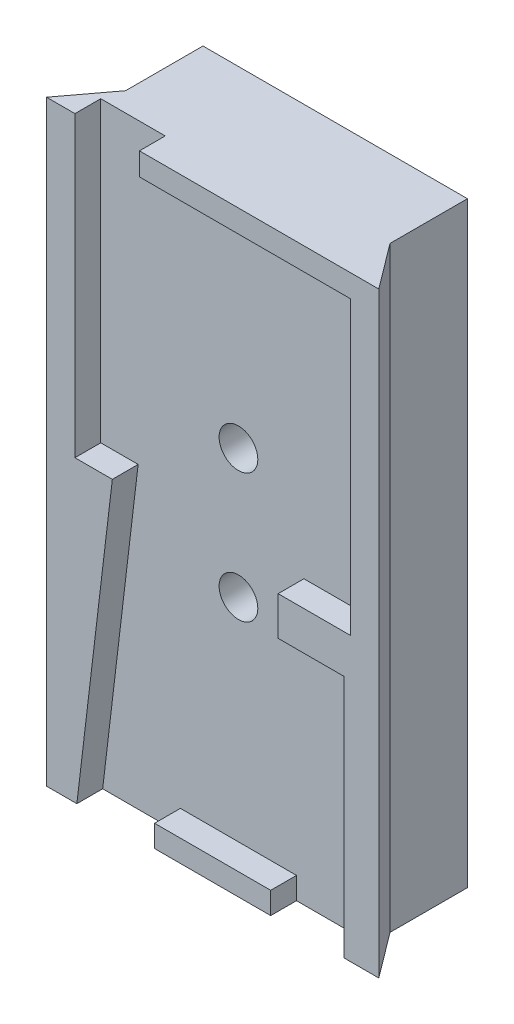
SolidWorks part; units mm, degrees
ref_plane "Спереди" through (0, 0, 0) normal (0, 0, 1) x (1, 0, 0)
ref_plane "Сверху" through (0, 0, 0) normal (0, 1, 0) x (1, 0, 0)
ref_plane "Справа" through (0, 0, 0) normal (1, 0, 0) x (0, 0, -1)
sketch "Эскиз1" plane through (0, 0, 0) normal (0, 1, 0) x (1, 0, 0)
  line L0 (0, 0) -> (0, 27.9699) construction
  line L1 (0, 0) -> (37.9449, 0) construction
  line L2 (-20.5, 0) -> (20.5, 0)
  line L3 (20.5, 0) -> (20.5, -12)
  line L4 (20.5, -12) -> (25.75, -19)
  line L5 (25.75, -19) -> (-25.75, -19)
  line L6 (0, 0) -> (0, -19) construction
  line L7 (-20.5, -12) -> (-25.75, -19)
  line L8 (-20.5, 0) -> (-20.5, -12)
  dimension "D1" = 41
  dimension "D2" = 7
  dimension "D3" = 12
  dimension "D4" = 51.5
extrude "Бобышка-Вытянуть1" add sketch "Эскиз1" along normal blind 92.5
sketch "Эскиз2" plane through (0, 0, 19) normal (0, 0, 1) x (1, 0, 0)
  line L0 (-21.05, 0) -> (-15.55, 46.3)
  line L1 (-25.75, 0) -> (25.75, 0) construction
  line L2 (-15.55, 46.3) -> (-21.35, 46.3)
  line L3 (-21.35, 46.3) -> (-21.35, 92.5)
  line L4 (-25.75, 92.5) -> (25.75, 92.5) construction
  line L5 (-21.35, 92.5) -> (-11.35, 92.5)
  line L6 (-11.35, 92.5) -> (-11.35, 89)
  line L7 (-11.35, 89) -> (21.35, 89)
  line L8 (21.35, 89) -> (21.35, 43.8)
  line L9 (21.35, 43.8) -> (10.15, 43.8)
  line L10 (10.15, 43.8) -> (10.15, 37.8)
  line L11 (10.15, 37.8) -> (20.35, 37.8)
  line L12 (20.35, 37.8) -> (20.35, 0)
  line L13 (20.35, 0) -> (9, 0)
  line L14 (9, 0) -> (9, 3.4)
  line L15 (9, 3.4) -> (-9, 3.4)
  line L16 (-9, 3.4) -> (-9, 0)
  line L17 (-9, 0) -> (-21.05, 0)
  line L18 (0, 0) -> (0, 22.4393) construction
  line L19 (25.75, 92.5) -> (25.75, 0) construction
  line L20 (-25.75, 92.5) -> (-25.75, 0) construction
  dimension "D1" = 18
  dimension "D2" = 3.4
  dimension "D3" = 5.4
  dimension "D4" = 6
  dimension "D5" = 15.6
  dimension "D6" = 3.5
  dimension "D7" = 4.4
  dimension "D8" = 10
  dimension "D9" = 46.2
  dimension "D10" = 5.8
  dimension "D11" = 4.7
  dimension "D12" = 37.8
  dimension "D13" = 4.4
extrude "Вырез-Вытянуть1" cut sketch "Эскиз2" against normal blind 4
sketch "Эскиз4" plane through (0, 0, 15) normal (0, 0, 1) x (1, 0, 0)
  line L0 (25.75, 46.25) -> (-25.75, 46.25) construction
  line L1 (25.75, 92.5) -> (25.75, 0) construction
  line L2 (-25.75, 92.5) -> (-25.75, 0) construction
  line L3 (0, 46.25) -> (0, 73.407) construction
  circle A0 centre (0, 56.25) radius 3
  circle A1 centre (0, 36.25) radius 3
  dimension "D1" = 6
  dimension "D2" = 20
extrude "Вырез-Вытянуть2" cut sketch "Эскиз4" against normal through all
